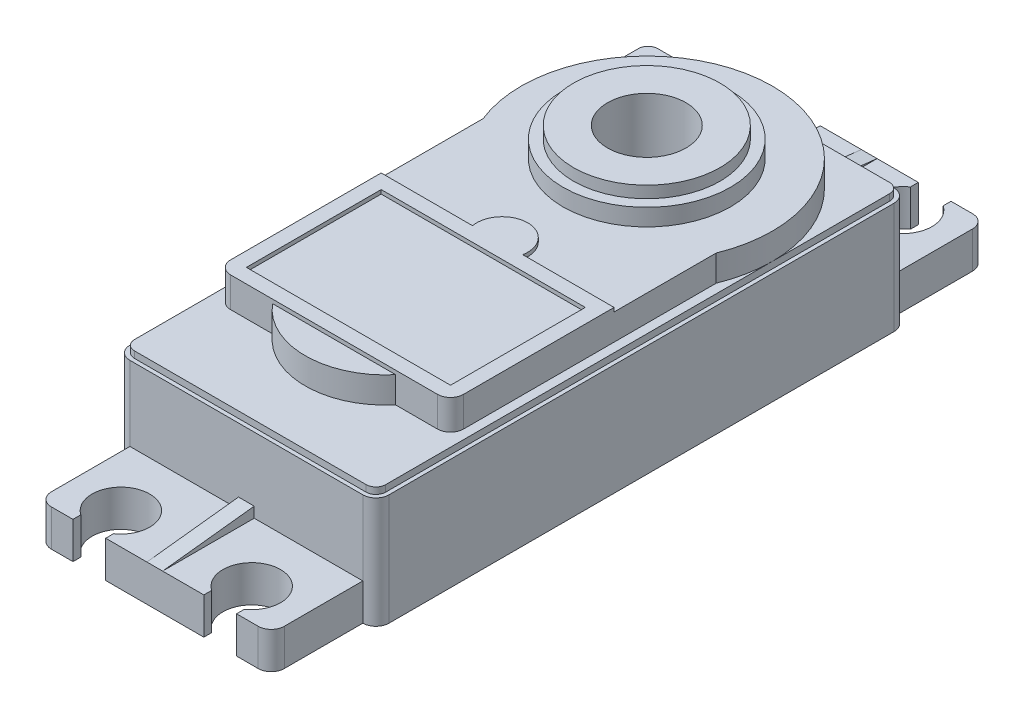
SolidWorks part; units mm, degrees
ref_plane "Front Plane" through (0, 0, 0) normal (0, 0, 1) x (1, 0, 0)
ref_plane "Top Plane" through (0, 0, 0) normal (0, 1, 0) x (1, 0, 0)
ref_plane "Right Plane" through (0, 0, 0) normal (1, 0, 0) x (0, 0, -1)
sketch "Sketch6" plane through (0, 0, 0) normal (0, 1, 0) x (1, 0, 0)
  line L0 (-9.9, 20.3) -> (9.9, -20.3) construction
  line L8 (9.9, 20.3) -> (-9.9, 20.3)
  line L9 (-9.9, 20.3) -> (-9.9, -20.3)
  line L10 (-9.9, -20.3) -> (9.9, -20.3)
  line L11 (9.9, -20.3) -> (9.9, 20.3)
  dimension "D1" = 40.6
  dimension "D2" = 19.8
extrude "Boss-Extrude3" add sketch "Sketch6" along normal blind 9 separate body
sketch "Sketch11" plane through (0, 9, 0) normal (0, 1, 0) x (1, 0, 0)
  line L0 (0, 0) -> (0, 10.3) construction
  line L1 (0, 10.3) -> (0, 20.3) construction
  line L3 (9.9, 20.3) -> (-9.9, 20.3) construction
  circle A0 centre (0, 10.3) radius 3
  dimension "D2" = 6
  dimension "D1" = 10
extrude "Cut-Extrude3" cut sketch "Sketch11" against normal up to next
sketch "Sketch12" plane through (0, 0, 20.3) normal (0, 0, 1) x (1, 0, 0)
  line L1 (-8.9, 2.8) -> (8.9, 2.8)
  line L2 (-8.9, 2.8) -> (-8.9, 0)
  line L3 (-8.9, 0) -> (8.9, 0)
  line L4 (8.9, 2.8) -> (8.9, 0)
  line L6 (-9.9, 0) -> (9.9, 0) construction
  dimension "D2" = 2.8
  dimension "D3" = 17.8
extrude "Boss-Extrude4" add sketch "Sketch12" along normal blind 7
sketch "Sketch13" plane through (0, 2.8, 0) normal (0, 1, 0) x (1, 0, 0)
  line L0 (0, -27.3) -> (0, -20.3) construction
  line L1 (8.9, -27.3) -> (-8.9, -27.3) construction
  line L2 (8.9, -20.3) -> (-8.9, -20.3) construction
  line L3 (-6.25, -26.7) -> (-6.25, -27.3)
  line L4 (-6.25, -27.3) -> (-3.75, -27.3)
  line L5 (-3.75, -27.3) -> (-3.75, -26.7)
  line L6 (-5, -24.8896) -> (-5, -27.3) construction
  arc A0 (-3.75, -26.7) -> (-6.25, -26.7) centre (-5, -24.8896) ccw
  dimension "D1" = 4.4
  dimension "D2" = 0.6
  dimension "D3" = 5
  dimension "D4" = 2.5
extrude "Cut-Extrude4" cut sketch "Sketch13" against normal through all
mirror "Mirror6" about plane through (0, 0, 0) normal (1, 0, 0) of "Cut-Extrude4"
sketch "Sketch20" plane through (0, 0, 0) normal (0, -1, 0) x (-1, 0, 0)
  line L0 (0, -20.3) -> (0, -27.3) construction
  line L1 (-8.9, -20.3) -> (8.9, -20.3) construction
  line L3 (3.75, -27.3) -> (-3.75, -27.3) construction
  circle A0 centre (0, -25.3) radius 0.7
  dimension "D1" = 1.4
  dimension "D2" = 5
extrude "Cut-Extrude7" cut sketch "Sketch20" against normal blind 0.5
sketch "Sketch21" plane through (0, 0, 0) normal (1, 0, 0) x (0, 0, -1)
  line L0 (-27.3, 2.8) -> (-20.3, 3.6)
  line L1 (-20.3, 9) -> (-20.3, 0) construction
  line L2 (-20.3, 3.6) -> (-20.3, 2.8)
  line L3 (-20.3, 2.8) -> (-27.3, 2.8)
  dimension "D1" = 0.8
extrude "Boss-Extrude8" add sketch "Sketch21" along normal mid plane 1.2
mirror "Mirror7" about plane through (0, 0, 0) normal (0, 0, 1) of "Boss-Extrude8", "Cut-Extrude7", "Mirror6", "Cut-Extrude4", "Boss-Extrude4"
sketch "Sketch28" plane through (0, 9, 0) normal (0, 1, 0) x (1, 0, 0)
  line L0 (-9.6, 20) -> (-9.6, -20)
  line L1 (-9.6, -20) -> (9.6, -20)
  line L2 (9.6, -20) -> (9.6, 20)
  line L3 (9.6, 20) -> (-9.6, 20)
  line L4 (-9.9, 20.3) -> (-9.9, -20.3)
  line L5 (-9.9, -20.3) -> (9.9, -20.3)
  line L6 (9.9, -20.3) -> (9.9, 20.3)
  line L7 (9.9, 20.3) -> (-9.9, 20.3)
  line L8 (-9.9, 20.3) -> (-9.9, -20.3)
  line L9 (-9.9, -20.3) -> (9.9, -20.3)
  line L10 (9.9, -20.3) -> (9.9, 20.3)
  line L11 (9.9, 20.3) -> (-9.9, 20.3)
  dimension "D1" = 0
  dimension "D2" = 0.3
sketch "Sketch16" plane through (0, 9, 0) normal (0, 1, 0) x (1, 0, 0)
  line L0 (-8.9, -13.5986) -> (8.9, -13.5986)
  line L1 (8.9, -13.5986) -> (8.9, 6.7014)
  line L2 (-8.9, -13.5986) -> (-8.9, 6.7014)
  line L3 (0, -13.5986) -> (0, 0) construction
  arc A0 (8.9, 6.7014) -> (-8.9, 6.7014) centre (0, 10.3) ccw
  circle A1 centre (0, 10.3) radius 3
  circle A3 centre (0, 10.3) radius 3 construction
  dimension "D1" = 19.2
  dimension "D3" = 20.3
  dimension "D2" = 17.8
extrude "Boss-Extrude6" add sketch "Sketch16" along normal blind 2
sketch "Sketch23" plane through (0, 9, 0) normal (0, 1, 0) x (1, 0, 0)
  line L1 (-4.7, -13.5986) -> (4.7, -13.5986) construction
  line L2 (-8.9, -13.5986) -> (8.9, -13.5986) construction
  line L3 (0, -13.5986) -> (0, -15.7986) construction
  line L7 (-8.9, -13.5986) -> (8.9, -13.5986)
  line L8 (-8.9, 6.7014) -> (-8.9, -13.5986)
  line L9 (8.9, -13.5986) -> (8.9, 6.7014)
  line L10 (-4.7, -13.5986) -> (4.7, -13.5986)
  arc A0 (-4.7, -13.5986) -> (4.7, -13.5986) centre (0, -9.6782) ccw
  arc A2 (8.9, 6.7014) -> (-8.9, 6.7014) centre (0, 10.3) ccw
  dimension "D1" = 2.2
  dimension "D2" = 9.4
  dimension "D3" = 0
extrude "Boss-Extrude9" add sketch "Sketch23" along normal up to surface (2 mm away)
sketch "Sketch24" plane through (0, 11, 0) normal (0, 1, 0) x (1, 0, 0)
  circle A0 centre (0, 10.3) radius 6.4
  circle A1 centre (0, 10.3) radius 3
  circle A2 centre (0, 10.3) radius 3 construction
  dimension "D1" = 12.8
extrude "Boss-Extrude10" add sketch "Sketch24" along normal blind 1.3
sketch "Sketch25" plane through (0, 12.3, 0) normal (0, 1, 0) x (1, 0, 0)
  circle A0 centre (0, 10.3) radius 5.6
  circle A1 centre (0, 10.3) radius 3
  circle A4 centre (0, 10.3) radius 3 construction
  dimension "D1" = 11.2
extrude "Boss-Extrude11" add sketch "Sketch25" along normal blind 0.9
sketch "Sketch26" plane through (0, 11, 0) normal (0, 1, 0) x (1, 0, 0)
  line L0 (-8.9, 6.7014) -> (-8.9, -13.5986) construction
  line L1 (-8.9, -1.0986) -> (8.9, -1.0986)
  line L2 (-8.9, -1.0986) -> (-8.9, -13.5986)
  line L3 (-8.9, -13.5986) -> (8.9, -13.5986)
  line L4 (8.9, -1.0986) -> (8.9, -13.5986)
  line L5 (-8.9, -1.0986) -> (8.9, -13.5986) construction
  line L6 (-8.9, -13.5986) -> (8.9, -1.0986) construction
  line L8 (-7.8, -2.1986) -> (7.8, -2.1986)
  line L9 (-7.8, -2.1986) -> (-7.8, -12.4986)
  line L10 (-7.8, -12.4986) -> (7.8, -12.4986)
  line L11 (7.8, -2.1986) -> (7.8, -12.4986)
  line L12 (-7.8, -2.1986) -> (7.8, -12.4986) construction
  line L13 (-7.8, -12.4986) -> (7.8, -2.1986) construction
  point P0 (0, -7.3486)
  point P8 (0, -7.3486)
  dimension "D1" = 12.5
  dimension "D2" = 1.1
  dimension "D3" = 1.1
extrude "Boss-Extrude12" add sketch "Sketch26" along normal blind 0.3
sketch "Sketch27" plane through (0, 11, 0) normal (0, 1, 0) x (1, 0, 0)
  line L0 (7.8, -2.1986) -> (-7.8, -2.1986) construction
  line L1 (1.3038, -2.1986) -> (-1.3038, -2.1986)
  line L2 (0, -2.1986) -> (0, 0) construction
  line L3 (0, 1.2014) -> (0, 0) construction
  arc A0 (1.3038, -2.1986) -> (-1.3038, -2.1986) centre (0, -0.7486) ccw
  dimension "D1" = 3.4
  dimension "D2" = 1.95
extrude "Boss-Extrude13" add sketch "Sketch27" along normal up to surface (0.3 mm away)
extrude "Cut-Extrude8" cut sketch "Sketch28" against normal blind 0.5
fillet "Fillet1" radius 1 10 edges at (-9.9, 4.25, -20.3) (9.9, 4.25, -20.3) (9.9, 4.25, 20.3) (-9.9, 4.25, 20.3) (-8.9, 10.15, 13.5986) (8.9, 10.15, 13.5986) (-8.9, 1.4, -27.3) (8.9, 1.4, -27.3) (8.9, 1.4, 27.3) (-8.9, 1.4, 27.3)
fillet "Fillet2" radius 0.75 4 edges at (-9.6, 8.75, -20) (9.6, 8.75, -20) (9.6, 8.75, 20) (-9.6, 8.75, 20)
